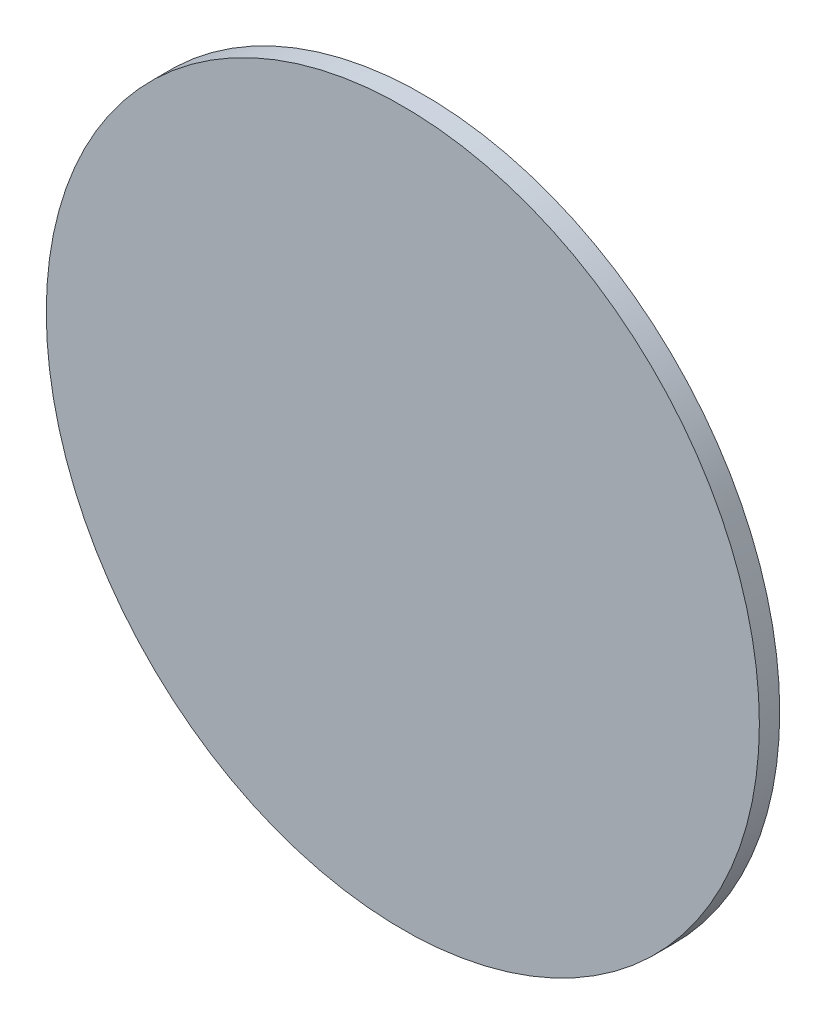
SolidWorks part; units mm, degrees
ref_plane "Plan de face" through (0, 0, 0) normal (0, 0, 1) x (1, 0, 0)
ref_plane "Plan de dessus" through (0, 0, 0) normal (0, 1, 0) x (1, 0, 0)
ref_plane "Plan de droite" through (0, 0, 0) normal (1, 0, 0) x (0, 0, -1)
sketch "Esquisse1" plane through (0, 0, 0) normal (0, 0, 1) x (1, 0, 0)
  circle A0 centre (0, 0) radius 17.5
extrude "Extrusion1" add sketch "Esquisse1" along normal blind 1
